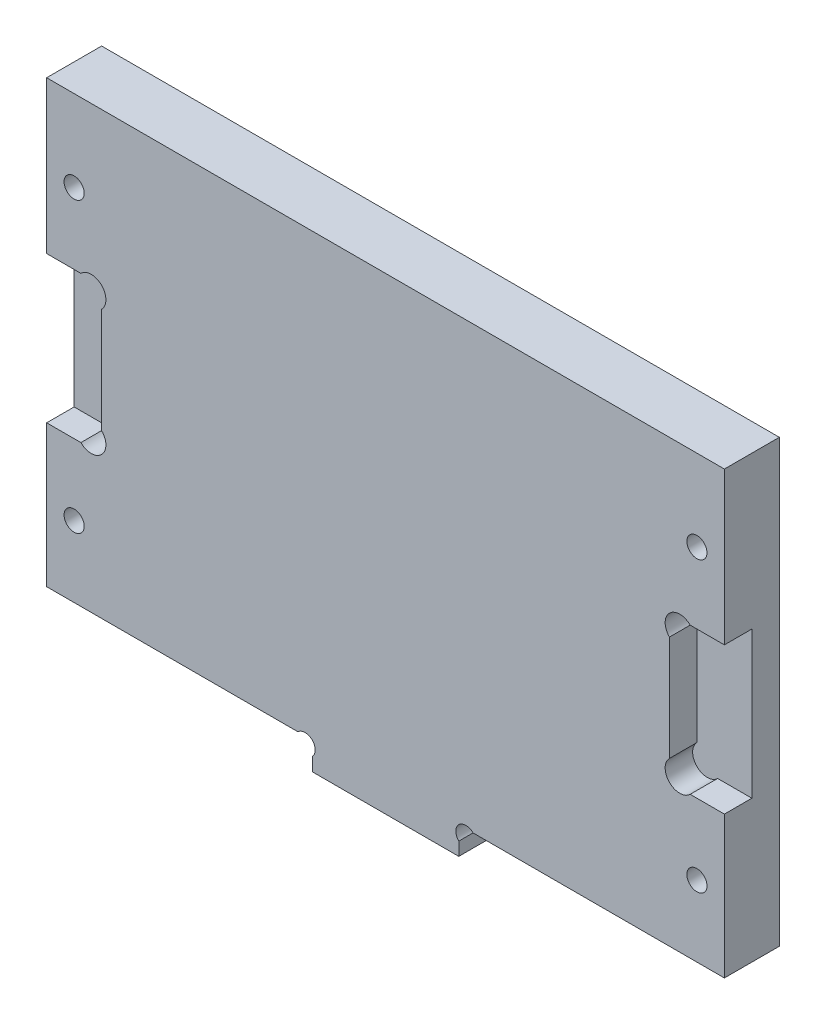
SolidWorks part; units mm, degrees
ref_plane "Plan de face" through (0, 0, 0) normal (0, 0, 1) x (1, 0, 0)
ref_plane "Plan de dessus" through (0, 0, 0) normal (0, 1, 0) x (1, 0, 0)
ref_plane "Plan de droite" through (0, 0, 0) normal (1, 0, 0) x (0, 0, -1)
sketch "Esquisse1" plane through (0, 0, 0) normal (0, 0, 1) x (1, 0, 0)
  line L0 (0, -5.0108) -> (0, 64.7054) construction
  line L1 (-6.2534, 0) -> (62.7329, 0) construction
  line L2 (74, -5.0108) -> (74, 64.7054) construction
  line L3 (-6.2534, 51.13) -> (62.7329, 51.13) construction
  line L4 (37, 58.598) -> (37, -8.0662) construction
  line L5 (54.1662, 26.5) -> (18.0574, 26.5) construction
  line L6 (49.4517, 18.5) -> (31.8795, 18.5) construction
  line L7 (44.8444, 10.75) -> (31.8795, 10.75) construction
  line L8 (71, 6.97) -> (71, 36.0279) construction
  line L9 (45, -7.9479) -> (45, 4.1955) construction
  line L10 (0, 51.13) -> (74, 51.13)
  line L11 (0, 51.13) -> (0, 3)
  line L12 (29, 0) -> (45, 0)
  line L13 (74, 51.13) -> (74, 3)
  line L14 (44.8444, 3) -> (15.0742, 3) construction
  line L15 (45, 3) -> (52.4678, -4.4678) construction
  line L16 (45, 1.4444) -> (45, 0)
  line L17 (29, 1.4444) -> (29, 0)
  line L18 (46.5556, 3) -> (74, 3)
  line L19 (27.4444, 3) -> (0, 3)
  circle A0 centre (71, 10.75) radius 1.1
  circle A1 centre (71, 42.25) radius 1.1
  circle A2 centre (3, 10.75) radius 1.1
  circle A3 centre (3, 42.25) radius 1.1
  arc A4 (46.5556, 3) -> (45, 1.4444) centre (45.7778, 2.2222) ccw
  arc A5 (27.4444, 3) -> (29, 1.4444) centre (28.2222, 2.2222) cw
  dimension "D8" = 3
  dimension "D1" = 74
  dimension "D2" = 51.13
  dimension "D3" = 37
  dimension "D4" = 26.5
  dimension "D5" = 8
  dimension "D6" = 7.75
  dimension "D7" = 3
  dimension "D9" = 8
  dimension "D10" = 45
extrude "Boss.-Extru.1" add sketch "Esquisse1" along normal blind 6
sketch "Esquisse2" plane through (0, 0, 6) normal (0, 0, 1) x (1, 0, 0)
  line L0 (37, 51.13) -> (37, 62.1338) construction
  line L2 (68, 59.5509) -> (68, -2.0702) construction
  line L3 (27.9169, 26.5) -> (46.4585, 26.5) construction
  line L4 (74, 3) -> (74, 51.13) construction
  line L5 (74, 51.13) -> (0, 51.13) construction
  line L6 (29, 0) -> (45, 0) construction
  line L7 (31.8835, 34.5) -> (46.4585, 34.5) construction
  line L8 (68, 34.5) -> (77.3748, 25.1252) construction
  line L9 (68, 32.2373) -> (68, 20.7627)
  line L10 (70.2627, 18.5) -> (74, 18.5)
  line L11 (70.2627, 34.5) -> (74, 34.5)
  line L12 (74, 34.5) -> (74, 18.5)
  line L13 (0, 34.5) -> (0, 18.5)
  line L14 (3.7373, 34.5) -> (0, 34.5)
  line L15 (3.7373, 18.5) -> (0, 18.5)
  line L16 (6, 32.2373) -> (6, 20.7627)
  arc A0 (70.2627, 34.5) -> (68, 32.2373) centre (69.1314, 33.3686) ccw
  arc A1 (70.2627, 18.5) -> (68, 20.7627) centre (69.1314, 19.6314) cw
  arc A2 (3.7373, 18.5) -> (6, 20.7627) centre (4.8686, 19.6314) ccw
  arc A3 (3.7373, 34.5) -> (6, 32.2373) centre (4.8686, 33.3686) cw
  dimension "D1" = 6
  dimension "D2" = 26.5
  dimension "D3" = 8
  dimension "D4" = 45
extrude "Enlèv. mat.-Extru.1" cut sketch "Esquisse2" against normal blind 3
